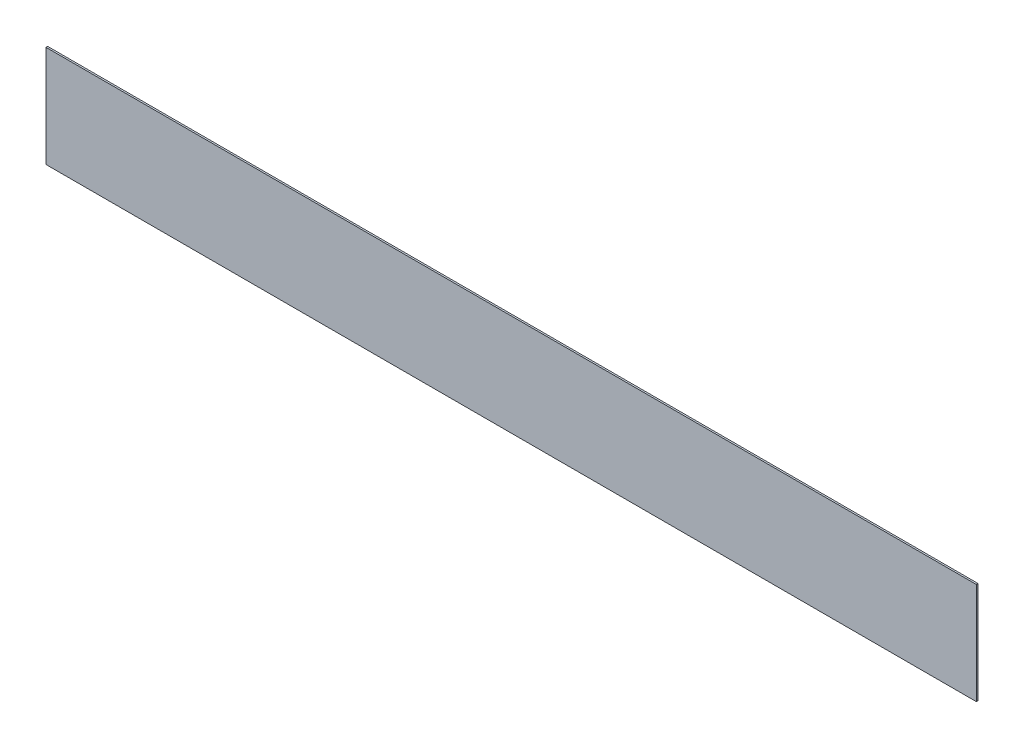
SolidWorks part; units mm, degrees
ref_plane "Plan de face" through (0, 0, 0) normal (0, 0, 1) x (1, 0, 0)
ref_plane "Plan de dessus" through (0, 0, 0) normal (0, 1, 0) x (1, 0, 0)
ref_plane "Plan de droite" through (0, 0, 0) normal (1, 0, 0) x (0, 0, -1)
sketch "EW_SKETCH" plane through (0, 0, 0) normal (1, 0, 0) x (0, 0, -1)
  line L0 (0, -30) -> (0, 30)
  line L1 (0, 30) -> (-1, 30)
  line L2 (-1, 30) -> (-1, -30)
  line L3 (-1, -30) -> (0, -30)
extrude "EW_EXTRUDE" add sketch "EW_SKETCH" along normal blind 550
equation "\"th_duct@EW_SKETCH\"=1"
